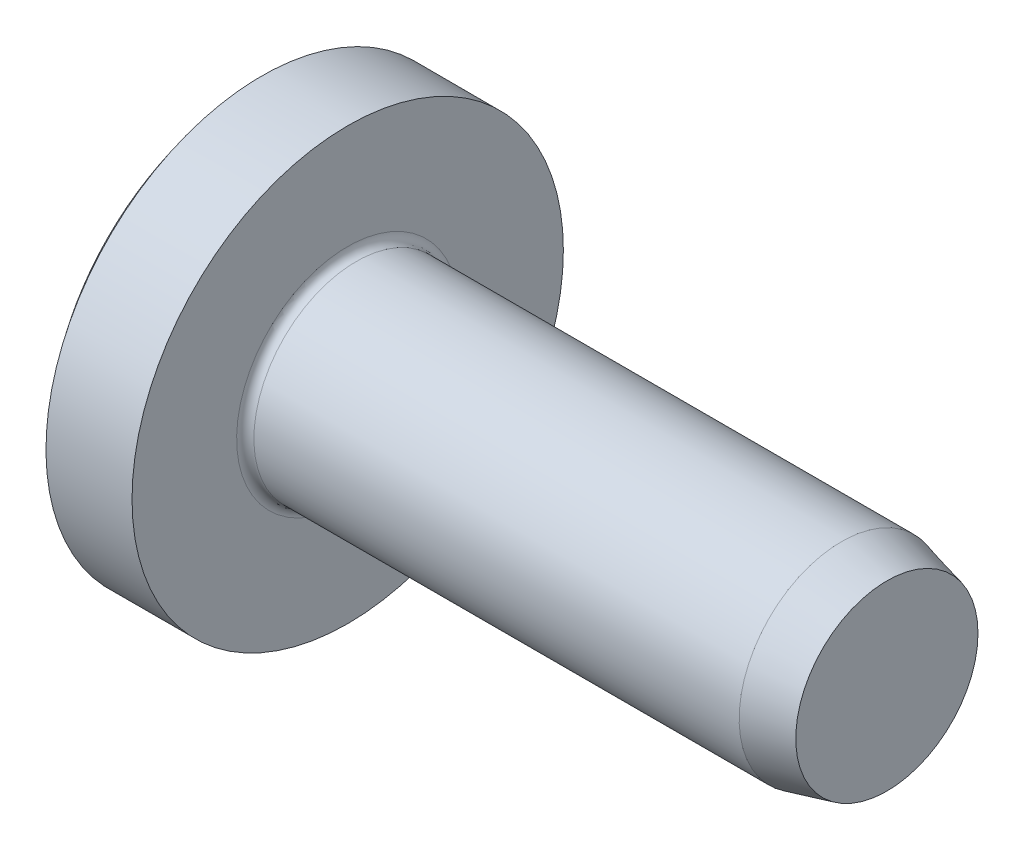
SolidWorks part; units mm, degrees
ref_plane "Front" through (0, 0, 0) normal (0, 0, 1) x (1, 0, 0)
ref_plane "Top" through (0, 0, 0) normal (0, 1, 0) x (1, 0, 0)
ref_plane "Right" through (0, 0, 0) normal (1, 0, 0) x (0, 0, -1)
sketch "Sketch1" plane through (0, 0, 0) normal (0, 0, 1) x (1, 0, 0)
  line L0 (-65.5475, 0) -> (9.6, 0) construction
  line L1 (32.5, 0) -> (32.5, 4.75)
  line L2 (32.5, 4.75) -> (7.5, 4.75)
  line L3 (7.5, 4.75) -> (7.5, 10)
  line L4 (7.5, 10) -> (3.51, 10)
  line L5 (32.5, 0) -> (0, 0)
  arc A0 (3.51, 10) -> (0, 0) centre (16, 0) ccw
  dimension "rf" = 16
  dimension "st" = 9.5
  dimension "k" = 7.5
  dimension "l" = 25
  dimension "dk" = 20
revolve "Base" add sketch "Sketch1" angle 360 about L0
sketch "Sketch2" plane through (0, 0, 0) normal (1, 0, 0) x (0, 0, -1)
  line L0 (6.5369, 0) -> (-7.0008, 0) construction
  line L1 (0, 6.811) -> (0, -6.4314) construction
  line L2 (-1.01, 5.05) -> (1.01, 5.05)
  line L3 (1.01, 5.05) -> (1.01, 1.01)
  line L4 (1.01, 1.01) -> (5.05, 1.01)
  line L5 (5.05, 1.01) -> (5.05, -1.01)
  line L6 (1.01, -1.01) -> (5.05, -1.01)
  line L7 (1.01, -5.05) -> (1.01, -1.01)
  line L8 (-1.01, -5.05) -> (1.01, -5.05)
  line L9 (-1.01, -5.05) -> (-1.01, -1.01)
  line L10 (-1.01, -1.01) -> (-5.05, -1.01)
  line L11 (-5.05, 1.01) -> (-5.05, -1.01)
  line L12 (-1.01, 1.01) -> (-5.05, 1.01)
  line L13 (-1.01, 5.05) -> (-1.01, 1.01)
  point P5 (-5.05, 0)
  point P11 (5.05, 0)
  point P15 (0, -5.05)
  point P20 (0, 5.05)
  dimension "m" = 10.1
  dimension "D2" = 10.1
  dimension "D3" = 2.02
  dimension "D4" = 2.02
extrude "CrossRecess" cut sketch "Sketch2" along normal blind 5.2
fillet "Fillet1" radius 0.4 1 edges at (7.5, -4.75, 0)
sketch "Sketch3" plane through (0, 0, 0) normal (1, 0, 0) x (0, 0, -1)
  line L0 (-4.5467, 4.5467) -> (4.5467, -4.5467) construction
  line L1 (-4.379, 4.379) -> (-1.01, 2.02)
  line L3 (-1.01, 2.02) -> (-1.01, 1.01)
  line L4 (-2.02, 1.01) -> (-1.01, 1.01)
  line L5 (-4.379, 4.379) -> (-2.02, 1.01)
  line L6 (7.069, 0) -> (-6.5067, 0) construction
  line L7 (0, 5.9645) -> (0, -0.3816) construction
  line L8 (4.379, 4.379) -> (2.02, 1.01)
  line L9 (2.02, 1.01) -> (1.01, 1.01)
  line L10 (1.01, 2.02) -> (1.01, 1.01)
  line L11 (4.379, 4.379) -> (1.01, 2.02)
  line L12 (4.379, -4.379) -> (1.01, -2.02)
  line L13 (1.01, -2.02) -> (1.01, -1.01)
  line L14 (2.02, -1.01) -> (1.01, -1.01)
  line L15 (4.379, -4.379) -> (2.02, -1.01)
  line L16 (-4.379, -4.379) -> (-2.02, -1.01)
  line L17 (-2.02, -1.01) -> (-1.01, -1.01)
  line L18 (-1.01, -2.02) -> (-1.01, -1.01)
  line L19 (-4.379, -4.379) -> (-1.01, -2.02)
  line L21 (1.01, 5.05) -> (1.01, 1.01) construction
  line L22 (1.01, 1.01) -> (5.05, 1.01) construction
  dimension "D1" = 20
  dimension "D2" = 1.01
extrude "Cut-Extrude2" [suppressed] cut sketch "Sketch3" along normal up to surface (5.2 mm away)
sketch "Sketch4" plane through (0, 0, 0) normal (0, 0, 1) x (1, 0, 0)
  line L0 (1.3282, 0) -> (-13.6388, 0) construction
  line L1 (7.9, -4.75) -> (32.5, -4.75) construction
  line L2 (28.3, -4.75) -> (30.4, -4.75)
  line L3 (30.4, -4.75) -> (32.5, -4.225)
  line L6 (28.3, -4.75) -> (28.3, -5.25)
  line L7 (28.3, -5.25) -> (32.5, -5.25)
  line L8 (32.5, -5.25) -> (32.5, -4.225)
  line L9 (32.5, -4.75) -> (32.5, 4.75) construction
  point P15 (30.4, -4.75)
  dimension "yf" = 4.2
  dimension "D2" = 2.1
  dimension "D3" = 0.525
  dimension "D4" = 0.5
revolve "Cut-Revolve1" cut sketch "Sketch4" angle 360 about L0
sketch "Sketch5" plane through (0, 0, 0) normal (0, 0, 1) x (1, 0, 0)
  line L0 (35.2407, 0) -> (11.9121, 0) construction
  line L2 (32.5, -4.75) -> (32.5, 4.75) construction
  line L3 (32.5, 0) -> (24.5, -4.75) construction
  line L6 (32.5, 0) -> (33, 0)
  line L7 (24.5, -4.75) -> (32.5, -4.75)
  line L8 (33, 0) -> (33, -4.75)
  line L9 (33, -4.75) -> (32.5, -4.75)
  arc A0 (32.5, 0) -> (24.5, -4.75) centre (12.3363, 24.8481) cw
  dimension "D1" = 32
  dimension "D2" = 0.5
  dimension "yc" = 8
  dimension "D3" = 9.5
revolve "Cut-Revolve6" [suppressed] cut sketch "Sketch5" angle 360 about L0
draft "Draft1" type of draft neutral plane draft angle 30 neutral plane "Right" faces to draft 4 parameters "D1"=30
sketch "Sketch6" plane through (0, 0, 0) normal (0, 0, 1) x (1, 0, 0)
  line L0 (7.9, 5.25) -> (7.9, 4.75)
  line L1 (7.9, 4.75) -> (8.15, 4.317)
  line L2 (8.15, 4.317) -> (8.4, 4.75)
  line L3 (8.4, 4.75) -> (8.4, 5.25)
  line L4 (8.4, 5.25) -> (7.9, 5.25)
  line L5 (0, 0) -> (34.661, 0) construction
  line L7 (7.9, -4.75) -> (7.9, 4.75) construction
  dimension "D1" = 0.5
  dimension "D2" = 9.5
revolve "Cut-Revolve10" [suppressed] cut sketch "Sketch6" angle 360 about L5
pattern_linear "LPattern10" [suppressed] count 41 along (1, 0, 0)
equation "\"D3@Sketch2\" = \"m@Sketch2\" / 5"
equation "\"D4@Sketch2\" = \"D3@Sketch2\""
equation "\"D2@Sketch2\" = \"m@Sketch2\""
equation "\"D2@Sketch3\" = \"m@Sketch2\" / 10"
equation "\"D3@Sketch4\" = \"yf@Sketch4\" / 8"
equation "\"D2@ThreadCosmetic1\" = \"st@Sketch1\" - 1"
equation "\"D1@Sketch5\" = \"yc@Sketch5\" * 4"
equation "\"D3@Sketch5\" = \"st@Sketch1\""
equation "\"D2@Sketch4\" = \"yf@Sketch4\" / 2"
equation "\"D2@Sketch6\" = \"st@Sketch1\""
equation "\"D1@ThreadCosmetic1\" = \"l@Sketch1\" "
equation "\"D1@Sketch6\" = (  \"D2@Sketch6\" - \"D2@ThreadCosmetic1\" )  / 2"
equation "\"pitch@LPattern10\" = \"D1@Sketch6\" * 1.2"
equation "\"D1@LPattern10\" = \"D1@ThreadCosmetic1\" / \"pitch@LPattern10\" - 1"
